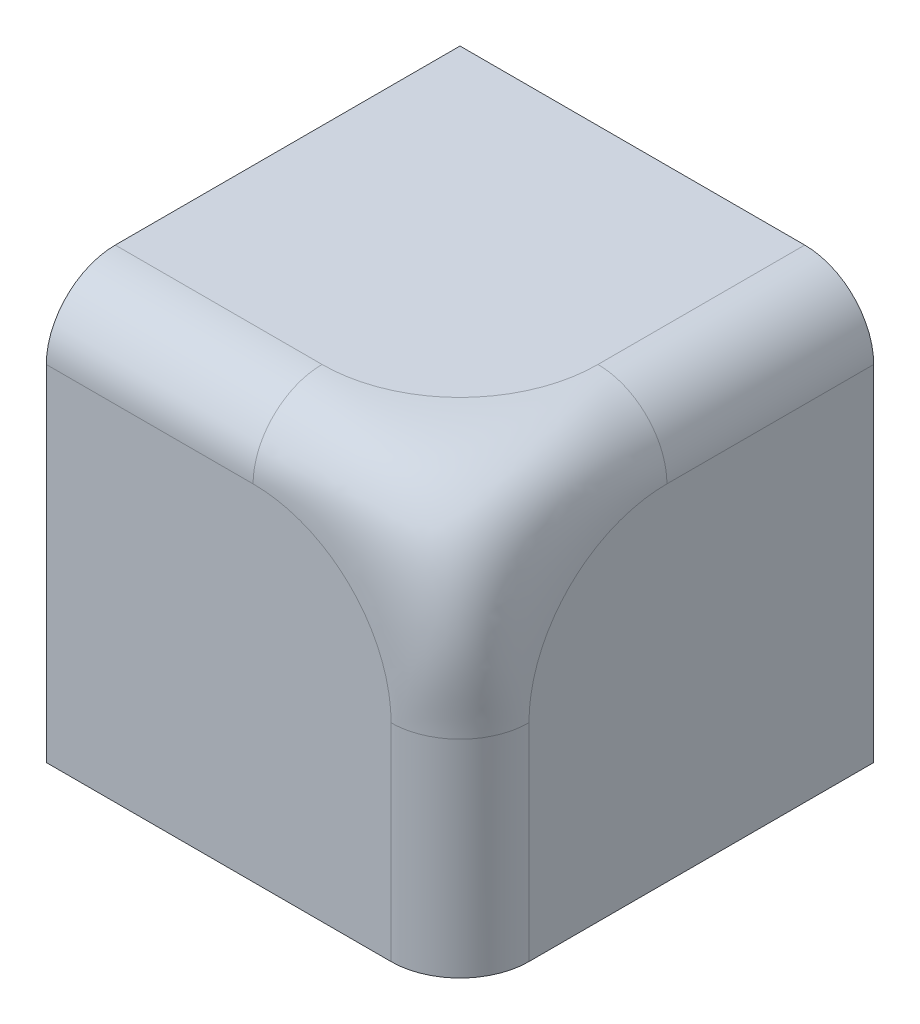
SolidWorks part; units mm, degrees
ref_plane "Front Plane" through (0, 0, 0) normal (0, 0, 1) x (1, 0, 0)
ref_plane "Top Plane" through (0, 0, 0) normal (0, 1, 0) x (1, 0, 0)
ref_plane "Right Plane" through (0, 0, 0) normal (1, 0, 0) x (0, 0, -1)
sketch "Sketch1" plane through (0, 0, 0) normal (0, 1, 0) x (1, 0, 0)
  line L1 (-76.2, -76.2) -> (76.2, -76.2)
  line L2 (-76.2, -76.2) -> (-76.2, 76.2)
  line L3 (-76.2, 76.2) -> (76.2, 76.2)
  line L4 (76.2, -76.2) -> (76.2, 76.2)
  line L5 (-76.2, -76.2) -> (76.2, 76.2) construction
  line L6 (-76.2, 76.2) -> (76.2, -76.2) construction
  point P0 (0, 0)
  dimension "D1" = 152.4
extrude "Boss-Extrude1" add sketch "Sketch1" along normal blind 152.4
fillet "Fillet1" radius 25.4 3 edges at (76.2, 76.2, 76.2) (76.2, 152.4, 0) (0, 152.4, 76.2)
sketch "Sketch2" plane through (0, 0, 76.2) normal (0, 0, 1) x (1, 0, 0)
  line L0 (0, 152.4) -> (0, 127)
  line L1 (-76.2, 152.4) -> (50.8, 152.4) construction
  line L2 (50.8, 127) -> (-76.2, 127) construction
  line L3 (0, 127) -> (-76.2, 127) construction
  line L4 (50.8, 0) -> (50.8, 76.2) construction
  line L5 (50.8, 0) -> (50.8, 127) construction
  line L6 (50.8, 76.2) -> (76.2, 76.2)
  line L7 (76.2, 127) -> (76.2, 0) construction
  arc A0 (0, 127) -> (50.8, 76.2) centre (0, 76.2) cw
  dimension "D1" = 76.2
sketch "Sketch3" plane through (76.2, 0, 0) normal (1, 0, 0) x (0, 0, -1)
  line L0 (-76.2, 76.2) -> (-50.8, 76.2)
  line L1 (-76.2, 127) -> (-76.2, 76.2) construction
  line L2 (-76.2, 0) -> (-76.2, 76.2) construction
  line L3 (-50.8, 127) -> (-50.8, 0) construction
  line L4 (-50.8, 76.2) -> (-50.8, 0) construction
  line L6 (92.6827, 56.172) -> (93.1088, 55.9589)
  line L7 (76.2, 127) -> (0, 127) construction
  line L8 (76.2, 127) -> (-50.8, 127) construction
  line L9 (0, 127) -> (0, 152.4)
  line L10 (-50.8, 152.4) -> (76.2, 152.4) construction
  arc A0 (-50.8, 76.2) -> (0, 127) centre (0, 76.2) cw
sketch "Sketch4" plane through (0, 152.4, 0) normal (0, 1, 0) x (1, 0, 0)
  line L0 (76.2, 0) -> (50.8, 0) construction
  line L1 (76.2, -50.8) -> (76.2, 0) construction
  line L2 (50.8, -50.8) -> (50.8, 76.2) construction
  line L3 (50.8, 0) -> (50.8, 76.2) construction
  line L4 (0, -76.2) -> (0, -50.8) construction
  line L5 (0, -76.2) -> (50.8, -76.2) construction
  line L6 (0, -76.2) -> (-76.2, -76.2) construction
  line L7 (-76.2, -50.8) -> (50.8, -50.8) construction
  line L8 (0, -50.8) -> (-76.2, -50.8) construction
  arc A0 (0, -50.8) -> (50.8, 0) centre (0, 0) ccw
other "DeleteFace1"
